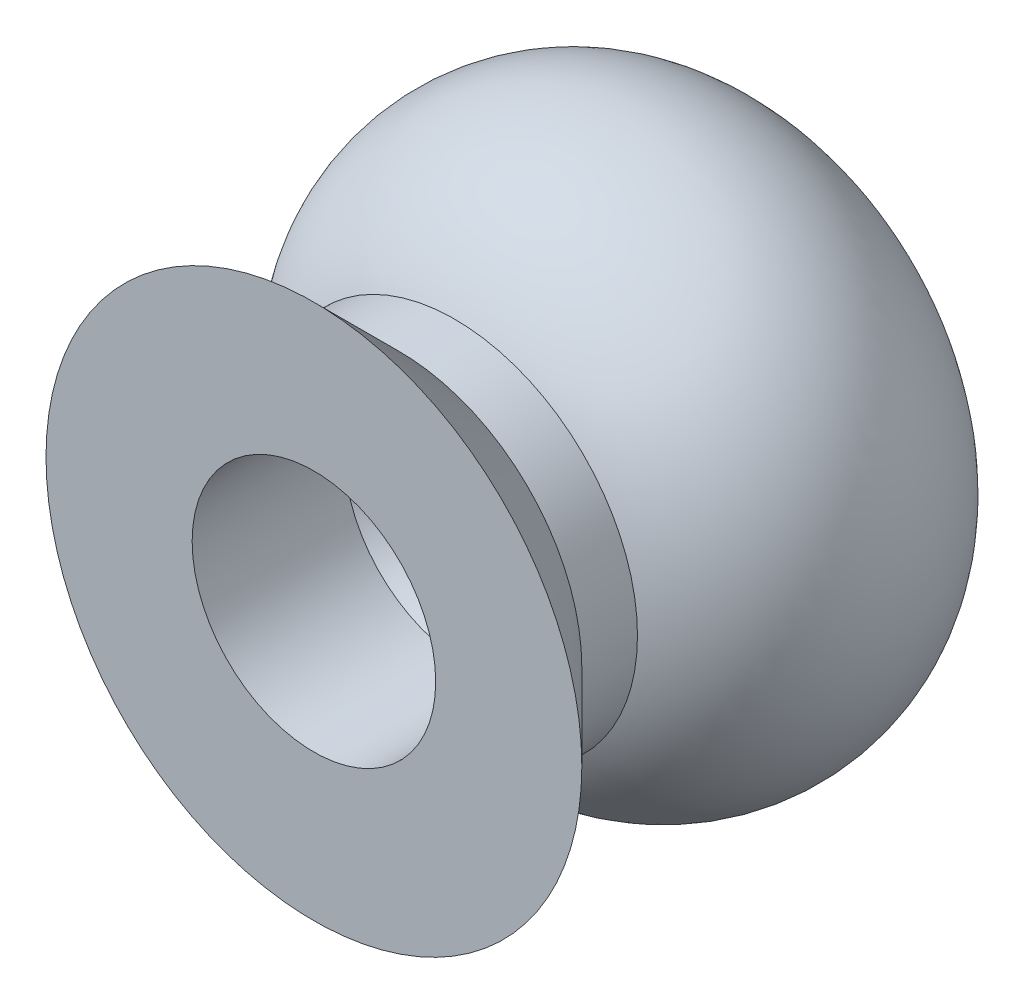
SolidWorks part; units mm, degrees
ref_plane "Přední" through (0, 0, 0) normal (0, 0, 1) x (1, 0, 0)
ref_plane "Horní" through (0, 0, 0) normal (0, 1, 0) x (1, 0, 0)
ref_plane "Pravá" through (0, 0, 0) normal (1, 0, 0) x (0, 0, -1)
sketch "Skica1" plane through (0, 0, 0) normal (1, 0, 0) x (0, 0, -1)
  line L0 (0, 0) -> (53.3313, 0) construction
  line L1 (0, 2) -> (0, 4.4)
  line L2 (0, 4.4) -> (1.4, 3)
  line L3 (1.4, 3) -> (2.3138, 3)
  line L4 (0, 2) -> (2.5, 2)
  line L5 (2.5, 2) -> (3.1062, 1.65)
  line L6 (3.1062, 1.65) -> (8, 1.65)
  line L7 (8, 1.65) -> (8, 1.6642)
  arc A0 (2.3138, 3) -> (8, 1.6642) centre (5, 1.6642) cw
  dimension "D6" = 3
  dimension "D1" = 1.65
  dimension "D2" = 8
  dimension "D3" = 6
  dimension "D4" = 1.4
  dimension "D5" = 45
  dimension "D7" = 2
  dimension "D8" = 5
  dimension "D9" = 1.6642
  dimension "D10" = 30
  dimension "D11" = 2.5
revolve "Otočit kolem osy1" add sketch "Skica1" angle 360 about L0
